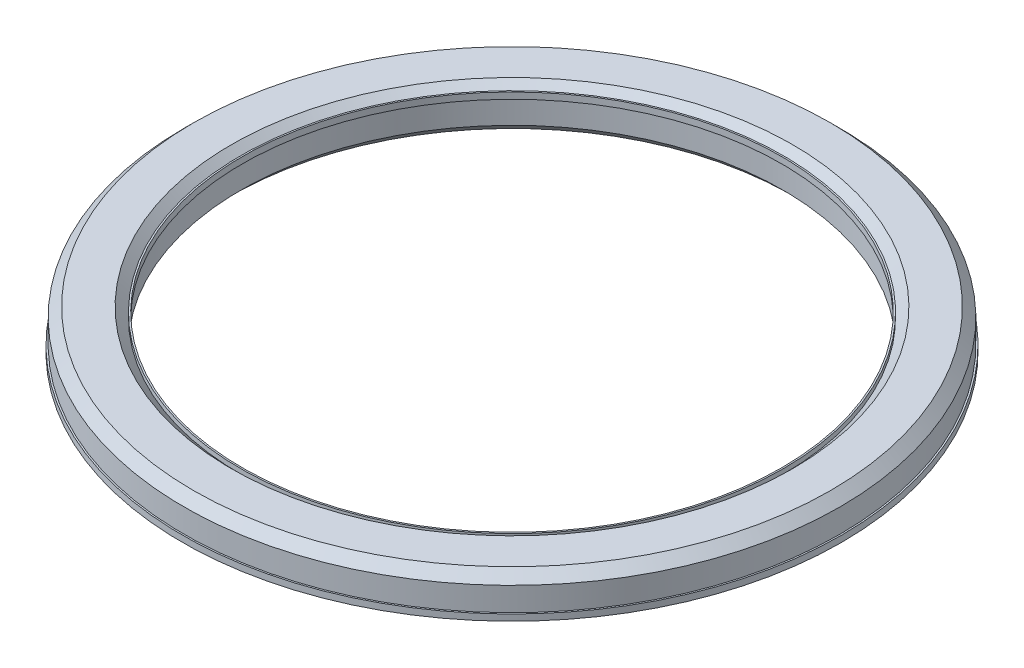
SolidWorks part; units mm, degrees
ref_plane "Front Plane" through (0, 0, 0) normal (0, 0, 1) x (1, 0, 0)
ref_plane "Top Plane" through (0, 0, 0) normal (0, 1, 0) x (1, 0, 0)
ref_plane "Right Plane" through (0, 0, 0) normal (1, 0, 0) x (0, 0, -1)
sketch "Sketch1" plane through (0, 0, 0) normal (0, 0, 1) x (1, 0, 0)
  line L0 (0, -50000) -> (0, 50000) construction
  line L1 (86000, -4000) -> (86000, 4000)
  line L2 (86000, 4000) -> (89000, 7000)
  line L3 (89000, 7000) -> (101000, 7000)
  line L4 (101000, 7000) -> (104000, 4000)
  line L5 (104000, 4000) -> (104000, -4000)
  line L6 (104000, -4000) -> (101000, -7000)
  line L7 (101000, -7000) -> (89000, -7000)
  line L8 (89000, -7000) -> (86000, -4000)
  line L9 (86850, -3500) -> (86850, 3500)
  line L10 (86850, 3500) -> (89500, 6150)
  line L11 (89500, 6150) -> (100500, 6150)
  line L12 (100500, 6150) -> (103150, 3500)
  line L13 (103150, 3500) -> (103150, -3500)
  line L14 (103150, -3500) -> (100500, -6150)
  line L15 (100500, -6150) -> (89500, -6150)
  line L16 (89500, -6150) -> (86850, -3500)
revolve "Revolve1" add sketch "Sketch1" angle 360 about L0
sketch "Sketch2" plane through (0, 0, 0) normal (0, 0, 1) x (1, 0, 0)
  line L0 (0, -50000) -> (0, 50000) construction
  line L2 (85500, 3500) -> (86000, 3500)
  line L3 (85500, 3500) -> (85500, 5500)
  line L4 (85500, 5500) -> (86000, 5500)
  line L5 (86000, 3500) -> (86000, 5500)
  line L6 (104000, -5500) -> (104500, -5500)
  line L7 (104000, -5500) -> (104000, -3500)
  line L8 (104000, -3500) -> (104500, -3500)
  line L9 (104500, -5500) -> (104500, -3500)
revolve "Revolve2" add sketch "Sketch2" angle 360 about L0
